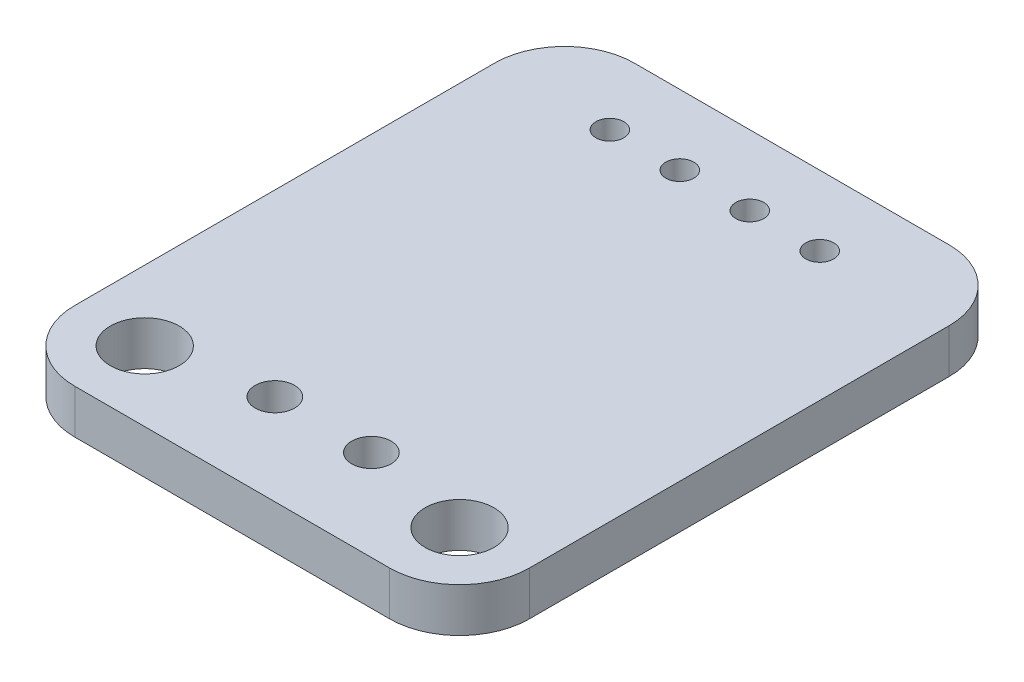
SolidWorks part; units mm, degrees
ref_plane "Front Plane" through (0, 0, 0) normal (0, 0, 1) x (1, 0, 0)
ref_plane "Top Plane" through (0, 0, 0) normal (0, 1, 0) x (1, 0, 0)
ref_plane "Right Plane" through (0, 0, 0) normal (1, 0, 0) x (0, 0, -1)
sketch "Sketch1" plane through (0, 0, 0) normal (0, 1, 0) x (1, 0, 0)
  line L0 (8.255, -10.16) -> (-8.255, 10.16) construction
  line L1 (-8.255, 10.16) -> (8.255, 10.16)
  line L2 (-8.255, 10.16) -> (-8.255, -10.16)
  line L3 (-8.255, -10.16) -> (8.255, -10.16)
  line L4 (8.255, 10.16) -> (8.255, -10.16)
  line L5 (-55, 0) -> (55, 0) construction
  line L6 (0, -55) -> (0, 55) construction
  point P4 (0, 0)
  dimension "D1" = 20.32
  dimension "D2" = 16.51
extrude "Boss-Extrude1" add sketch "Sketch1" along normal blind 1.6002
sketch "Sketch2" plane through (0, 1.6002, 0) normal (0, 1, 0) x (1, 0, 0)
  line L0 (5.715, -7.62) -> (-5.715, -7.62) construction
  line L1 (0, -0.8801) -> (0, 0.8801) construction
  line L2 (-8.255, -10.16) -> (8.255, -10.16) construction
  circle A0 centre (-5.715, -7.62) radius 1.25
  circle A1 centre (5.715, -7.62) radius 1.25
  dimension "D4" = 2.5
  dimension "D1" = 11.43
  dimension "D2" = 5.715
  dimension "D3" = 2.54
extrude "Cut-Extrude1" cut sketch "Sketch2" against normal up to next
sketch "Sketch3" plane through (0, 1.6002, 0) normal (0, 1, 0) x (1, 0, 0)
  line L0 (-1002.3313, 7.62) -> (48997.6687, 7.62) construction
  line L1 (-8.255, -10.16) -> (8.255, -10.16) construction
  circle A0 centre (-4.066, 7.62) radius 0.508
  circle A1 centre (-1.526, 7.62) radius 0.508
  circle A2 centre (1.014, 7.62) radius 0.508
  circle A3 centre (3.554, 7.62) radius 0.508
  dimension "D5" = 1.016
  dimension "D1" = 17.78
  dimension "D2" = 2.54
  dimension "D3" = 2.54
  dimension "D4" = 2.54
extrude "Cut-Extrude2" cut sketch "Sketch3" against normal up to next
fillet "Fillet1" radius 2.54 4 edges at (-8.255, 0.8001, -10.16) (8.255, 0.8001, -10.16) (8.255, 0.8001, 10.16) (-8.255, 0.8001, 10.16)
sketch "Sketch4" plane through (0, 1.6002, 0) normal (0, 1, 0) x (1, 0, 0)
  line L0 (0, -0.8801) -> (0, 0.8801) construction
  line L1 (-5.715, -10.16) -> (5.715, -10.16) construction
  line L2 (0, -1006.3846) -> (0, 48993.6154) construction
  circle A0 centre (-1.7526, -6.858) radius 0.7161
  circle A1 centre (1.7526, -6.858) radius 0.7161
  dimension "D1" = 1.7526
  dimension "D2" = 3.302
extrude "Cut-Extrude3" cut sketch "Sketch4" against normal up to next
